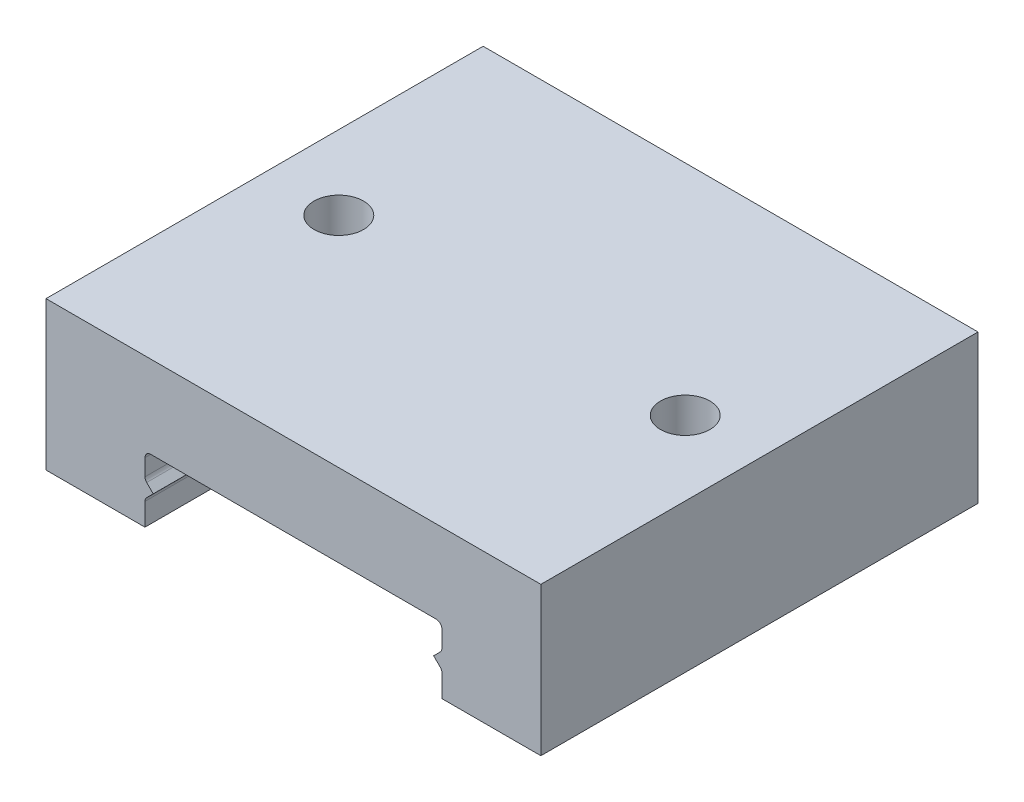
SolidWorks part; units mm, degrees
ref_plane "Front" through (0, 0, 0) normal (0, 0, 1) x (1, 0, 0)
ref_plane "Top" through (0, 0, 0) normal (0, 1, 0) x (1, 0, 0)
ref_plane "Right" through (0, 0, 0) normal (1, 0, 0) x (0, 0, -1)
sketch "Sketch1" plane through (0, 0, 0) normal (0, 0, 1) x (1, 0, 0)
  line L1 (-15, 12) -> (15, 12)
  line L2 (-15, 12) -> (-15, 3)
  line L3 (-15, 3) -> (15, 3)
  line L4 (15, 12) -> (15, 3)
  point P4 (0, 3)
  dimension "D1" = 30
  dimension "D2" = 9
  dimension "D3" = 12
extrude "Extrude1" add sketch "Sketch1" along normal blind 26.5
sketch "Sketch2" plane through (0, 0, 0) normal (0, 0, -1) x (-1, 0, 0)
  line L0 (8.5, 5) -> (9, 4.5)
  line L1 (0, 7) -> (9, 7)
  line L2 (0, 7) -> (0, 0.8302)
  line L3 (0, 0.8302) -> (9, 0.8302)
  line L4 (9, 0.8302) -> (9, 4.5)
  line L5 (9, 7) -> (9, 5.5)
  line L6 (9, 5.5) -> (8.5, 5)
  dimension "D1" = 7
  dimension "D2" = 9
  dimension "D3" = 1
  dimension "D4" = 1.5
extrude "Cut-Extrude1" cut sketch "Sketch2" against normal through all
fillet "Fillet1" radius 0.35
mirror "Mirror1" about plane through (0, 0, 0) normal (1, 0, 0)
hole_wizard "M3x0.5 Tapped Hole1" positions "Sketch4" profile "Sketch3" tap size "M3x0.5" standard "Ansi Metric"
sketch "Sketch4" plane through (0, 12, 0) normal (0, 1, 0) x (-1, 0, 0)
  line L0 (-15, 0) -> (15, 0) construction
  line L1 (15, 26.5) -> (15, 0) construction
  point P0 (10.5, 13.25)
  dimension "D1" = 13.25
  dimension "D2" = 4.5
sketch "Sketch3" plane through (-10.5, 12, 13.25) normal (1, 0, 0) x (0, 0, 1)
  line L0 (0, 0) -> (0, 5.2511)
  line L1 (0, 5.2511) -> (1.25, 4.5)
  line L2 (1.25, 4.5) -> (1.25, 3)
  line L3 (1.25, 3) -> (1.5, 3)
  line L4 (1.5, 3) -> (1.5, 0)
  line L5 (1.5, 0) -> (0, 0)
  line L10 (0, 5.2511) -> (-1.25, 4.5) construction
  line L11 (0, -6.35) -> (0, 107.95) construction
  dimension "Tap Drill Dia." = 2.5
  dimension "Tap Drill Depth" = 4.5
  dimension "Thread Major Dia." = 3
  dimension "Thread Depth" = 3
  dimension "Drill Angle" = 118
pattern_linear "LPattern1" count 2 spacing 21
